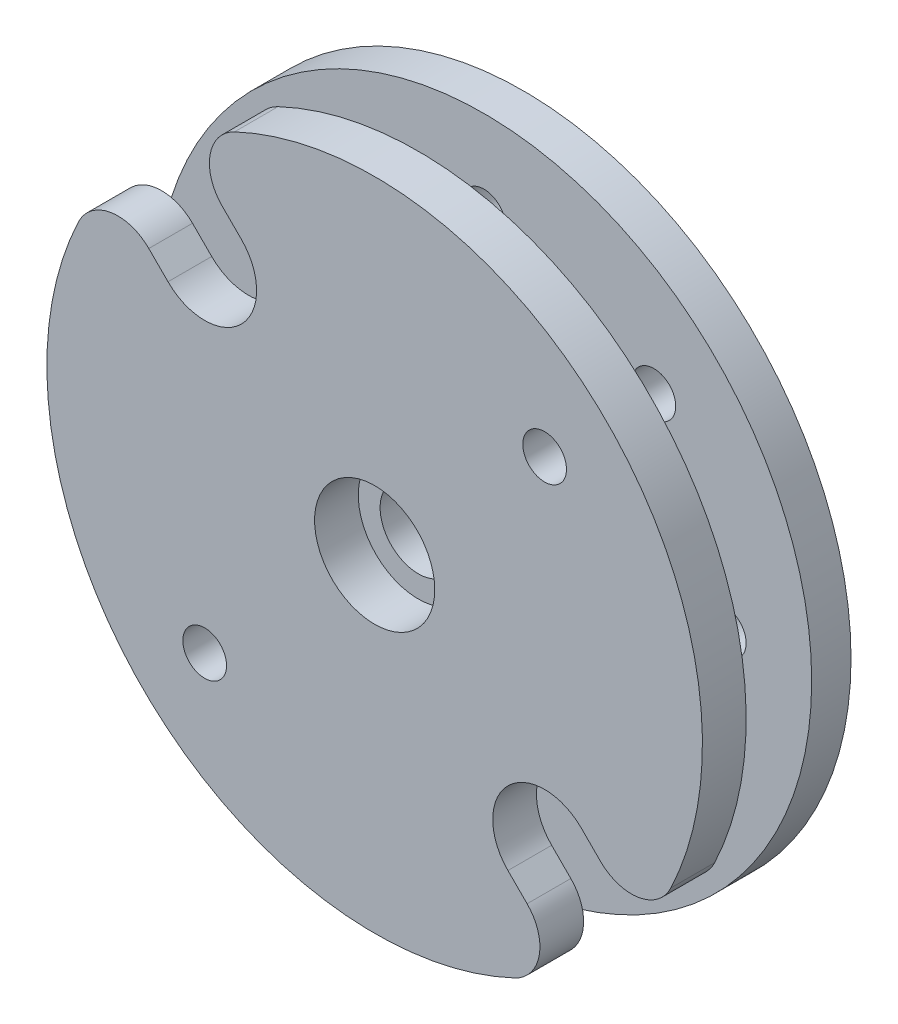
SolidWorks part; units mm, degrees
ref_plane "Front Plane" through (0, 0, 0) normal (0, 0, 1) x (1, 0, 0)
ref_plane "Top Plane" through (0, 0, 0) normal (0, 1, 0) x (1, 0, 0)
ref_plane "Right Plane" through (0, 0, 0) normal (1, 0, 0) x (0, 0, -1)
sketch "Sketch1" plane through (0, 0, 0) normal (0, 0, 1) x (1, 0, 0)
  line L0 (0, 0) -> (0, 15) construction
  circle A0 centre (0, 0) radius 15
  circle A1 centre (0, 0) radius 5.25
  circle A2 centre (0, 11) radius 1
  circle A3 centre (7.7782, 7.7782) radius 1
  circle A4 centre (11, 0) radius 1
  circle A5 centre (7.7782, -7.7782) radius 1
  circle A6 centre (0, -11) radius 1
  circle A7 centre (-7.7782, -7.7782) radius 1
  circle A8 centre (-11, 0) radius 1
  circle A10 centre (-7.7782, 7.7782) radius 2.25
  circle A11 centre (-7.7782, 7.7782) radius 1
  point P23 (0, 0)
  dimension "D1" = 30
  dimension "D2" = 10.5
  dimension "D3" = 2
  dimension "D4" = 11
  dimension "D6" = 4.5
  dimension "D5" = 8
extrude "Boss-Extrude1" add sketch "Sketch1" against normal blind 1.8
sketch "Sketch2" plane through (0, 0, 0) normal (0, 0, 1) x (1, 0, 0)
  circle A0 centre (0, 0) radius 6.25
  circle A1 centre (0, 0) radius 1.75
  dimension "D1" = 12.5
extrude "Boss-Extrude2" add sketch "Sketch2" along normal blind 3
sketch "Sketch3" plane through (0, 0, 3) normal (0, 0, 1) x (1, 0, 0)
  circle A0 centre (0, 0) radius 8.75
  circle A2 centre (0, 0) radius 2.75
  dimension "D1" = 17.5
  dimension "D2" = 5.5
extrude "Boss-Extrude3" add sketch "Sketch3" along normal blind 2
sketch "Sketch4" plane through (0, 0, 0) normal (0, 0, 1) x (1, 0, 0)
  circle A0 centre (7.7782, -7.7782) radius 2.375
  circle A1 centre (-7.7782, 7.7782) radius 2.375
  dimension "D1" = 4.75
  dimension "D2" = 4.75
extrude "Cut-Extrude1" cut sketch "Sketch4" against normal through all
sketch "Sketch5" plane through (0, 0, 5) normal (0, 0, 1) x (1, 0, 0)
  line L0 (0, 8.75) -> (0, -8.75) construction
  circle A0 centre (0, 0) radius 8.75 construction
  circle A1 centre (0, 0) radius 8.75
  circle A2 centre (0, 0) radius 15
  circle A3 centre (0, 0) radius 15 construction
extrude "Boss-Extrude4" add sketch "Sketch5" against normal up to surface (2 mm away)
sketch "Sketch6" plane through (0, 0, 5) normal (0, 0, 1) x (1, 0, 0)
  line L0 (-7.7782, 7.7782) -> (7.7782, -7.7782) construction
  line L1 (-7.7782, 7.7782) -> (-6.0988, 9.4576) construction
  line L2 (0, 0) -> (7.7782, 7.7782) construction
  line L3 (-9.4576, 6.0988) -> (-12.1522, 8.7934)
  line L4 (-6.0988, 9.4576) -> (-8.7934, 12.1522)
  line L5 (7.7782, -7.7782) -> (9.4576, -6.0988) construction
  line L6 (9.4576, -6.0988) -> (12.1522, -8.7934)
  line L7 (6.0988, -9.4576) -> (8.7934, -12.1522)
  circle A0 centre (-7.7782, 7.7782) radius 2.375 construction
  arc A1 (-6.0988, 9.4576) -> (-9.4576, 6.0988) centre (-7.7782, 7.7782) cw
  circle A2 centre (0, 0) radius 15 construction
  arc A3 (-12.1522, 8.7934) -> (-8.7934, 12.1522) centre (0, 0) cw
  arc A4 (8.7934, -12.1522) -> (12.1522, -8.7934) centre (0, 0) ccw
  arc A5 (9.4576, -6.0988) -> (6.0988, -9.4576) centre (7.7782, -7.7782) ccw
  point P0 (-7.7782, 7.7782)
  point P1 (7.7782, -7.7782)
extrude "Cut-Extrude2" cut sketch "Sketch6" against normal up to surface (2 mm away)
sketch "Sketch8" plane through (0, 0, -1.8) normal (0, 0, -1) x (-1, 0, 0)
  circle A0 centre (-7.7782, 7.7782) radius 1
  circle A1 centre (7.7782, -7.7782) radius 1
extrude "Cut-Extrude3" cut sketch "Sketch8" against normal through all
fillet "Fillet1" radius 2 4 edges at (12.1522, -8.7934, 4) (8.7934, -12.1522, 4) (-12.1522, 8.7934, 4) (-8.7934, 12.1522, 4)
chamfer "Chamfer1" distance 0.75 angle 45 2 edges at (6.25, 0, 3) (6.25, 0, 0)
